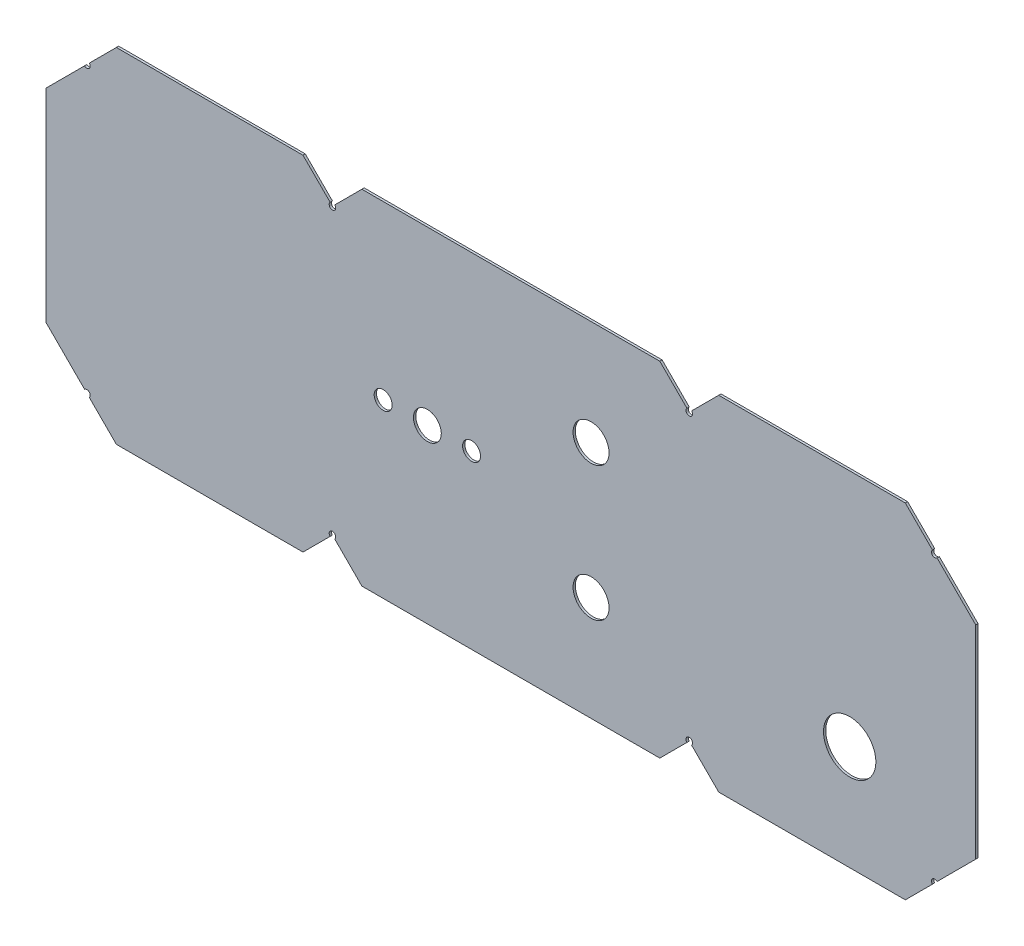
SolidWorks part; units mm, degrees
ref_plane "Ön Düzlem" through (0, 0, 0) normal (0, 0, 1) x (1, 0, 0)
ref_plane "Üst Düzlem" through (0, 0, 0) normal (0, 1, 0) x (1, 0, 0)
ref_plane "Sağ Düzlem" through (0, 0, 0) normal (1, 0, 0) x (0, 0, -1)
sketch "Çizim1" plane through (0, 0, 0) normal (0, 0, 1) x (1, 0, 0)
  line L0 (10.4393, 94.9393) -> (10.7929, 95.2929)
  line L1 (20.5, 105) -> (77.5, 105)
  line L2 (12.5607, 97.0607) -> (12.2071, 96.7071)
  line L3 (261.5, 0) -> (204.5, 0)
  line L4 (132, 0) -> (95.5, 0)
  line L5 (150, 105) -> (186.5, 105)
  line L6 (132, 0) -> (150, 0)
  line L7 (271.5607, 10.0607) -> (282, 20.5)
  line L8 (269.4393, 7.9393) -> (261.5, 0)
  line L9 (77.5, 0) -> (20.5, 0)
  line L10 (186.5, 0) -> (150, 0)
  line L11 (12.5607, 7.9393) -> (20.5, 0)
  line L12 (10.4393, 10.0607) -> (0, 20.5)
  line L13 (10.4393, 94.9393) -> (0, 84.5)
  line L14 (12.5607, 97.0607) -> (20.5, 105)
  line L15 (87.5607, 97.0607) -> (95.5, 105)
  line L16 (85.4393, 97.0607) -> (77.5, 105)
  line L17 (269.4393, 97.0607) -> (261.5, 105)
  line L18 (271.5607, 94.9393) -> (282, 84.5)
  line L19 (194.4393, 97.0607) -> (186.5, 105)
  line L20 (196.5607, 97.0607) -> (204.5, 105)
  line L21 (95.5, 105) -> (132, 105)
  line L22 (204.5, 105) -> (261.5, 105)
  line L23 (132, 105) -> (150, 105)
  line L24 (282, 84.5) -> (283, 83.5)
  line L25 (196.5607, 7.9393) -> (204.5, 0)
  line L26 (194.4393, 7.9393) -> (186.5, 0)
  line L27 (87.5607, 7.9393) -> (95.5, 0)
  line L28 (85.4393, 7.9393) -> (77.5, 0)
  line L29 (283, 83.5) -> (283, 21.5)
  line L30 (-1, 83.5) -> (-1, 21.5)
  line L31 (0, 20.5) -> (-1, 21.5)
  line L32 (0, 84.5) -> (-1, 83.5)
  line L33 (282, 20.5) -> (283, 21.5)
  line L34 (85.4393, 97.0607) -> (85.7929, 96.7071)
  line L35 (87.5607, 97.0607) -> (87.2071, 96.7071)
  line L36 (194.4393, 97.0607) -> (194.7929, 96.7071)
  line L37 (196.5607, 97.0607) -> (196.2071, 96.7071)
  line L38 (269.4393, 97.0607) -> (269.7929, 96.7071)
  line L39 (271.5607, 94.9393) -> (271.2071, 95.2929)
  line L40 (269.4393, 7.9393) -> (269.7929, 8.2929)
  line L41 (271.5607, 10.0607) -> (271.2071, 9.7071)
  line L42 (194.4393, 7.9393) -> (194.7929, 8.2929)
  line L43 (196.5607, 7.9393) -> (196.2071, 8.2929)
  line L44 (85.4393, 7.9393) -> (85.7929, 8.2929)
  line L45 (87.5607, 7.9393) -> (87.2071, 8.2929)
  line L46 (10.4393, 10.0607) -> (10.7929, 9.7071)
  line L47 (12.5607, 7.9393) -> (12.2071, 8.2929)
  circle A5 centre (244.5, 32) radius 8
  circle A9 centre (102, 52.5) radius 2.75
  circle A10 centre (165.5, 73) radius 5.5
  circle A11 centre (165.5, 32) radius 5.5
  circle A12 centre (129, 52.5) radius 2.75
  circle A13 centre (115.5, 52.5) radius 4.25
  arc A14 (10.7929, 95.2929) -> (12.2071, 96.7071) centre (11.5, 96) ccw
  arc A15 (12.2071, 8.2929) -> (10.7929, 9.7071) centre (11.5, 9) ccw
  arc A16 (87.2071, 8.2929) -> (85.7929, 8.2929) centre (86.5, 9) ccw
  arc A17 (196.2071, 8.2929) -> (194.7929, 8.2929) centre (195.5, 9) ccw
  arc A18 (271.2071, 9.7071) -> (269.7929, 8.2929) centre (270.5, 9) ccw
  arc A19 (269.7929, 96.7071) -> (271.2071, 95.2929) centre (270.5, 96) ccw
  arc A20 (194.7929, 96.7071) -> (196.2071, 96.7071) centre (195.5, 96) ccw
  arc A21 (85.7929, 96.7071) -> (87.2071, 96.7071) centre (86.5, 96) ccw
extrude "Yükseklik-Ekstrüzyon1" add sketch "Çizim1" along normal blind 0.7
